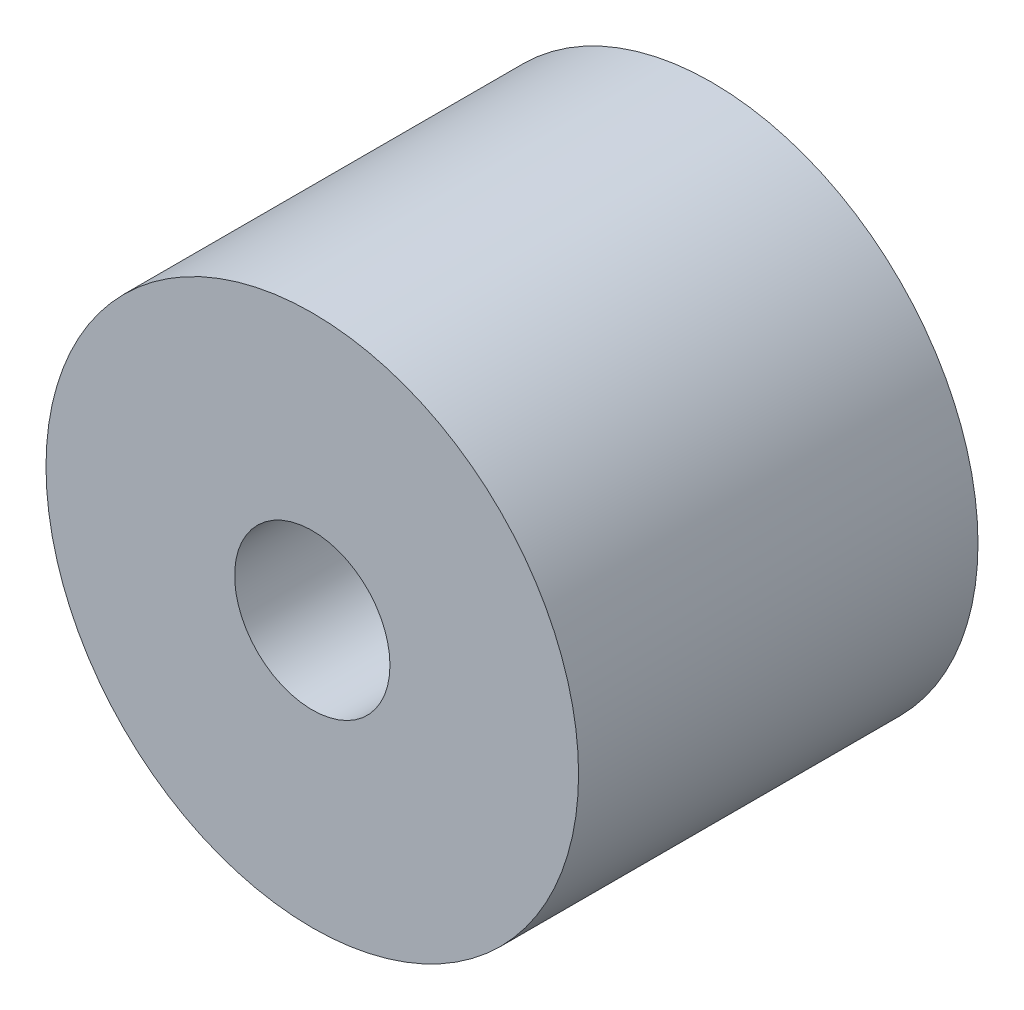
SolidWorks part; units mm, degrees
ref_plane "Plan de face" through (0, 0, 0) normal (0, 0, 1) x (1, 0, 0)
ref_plane "Plan de dessus" through (0, 0, 0) normal (0, 1, 0) x (1, 0, 0)
ref_plane "Plan de droite" through (0, 0, 0) normal (1, 0, 0) x (0, 0, -1)
sketch "Esquisse1" plane through (0, 0, 0) normal (0, 0, 1) x (1, 0, 0)
  circle A0 centre (0, 0) radius 1.75
  circle A1 centre (0, 0) radius 6
  dimension "D1" = 3.5
  dimension "D2" = 12
extrude "Boss.-Extru.1" add sketch "Esquisse1" along normal blind 9
